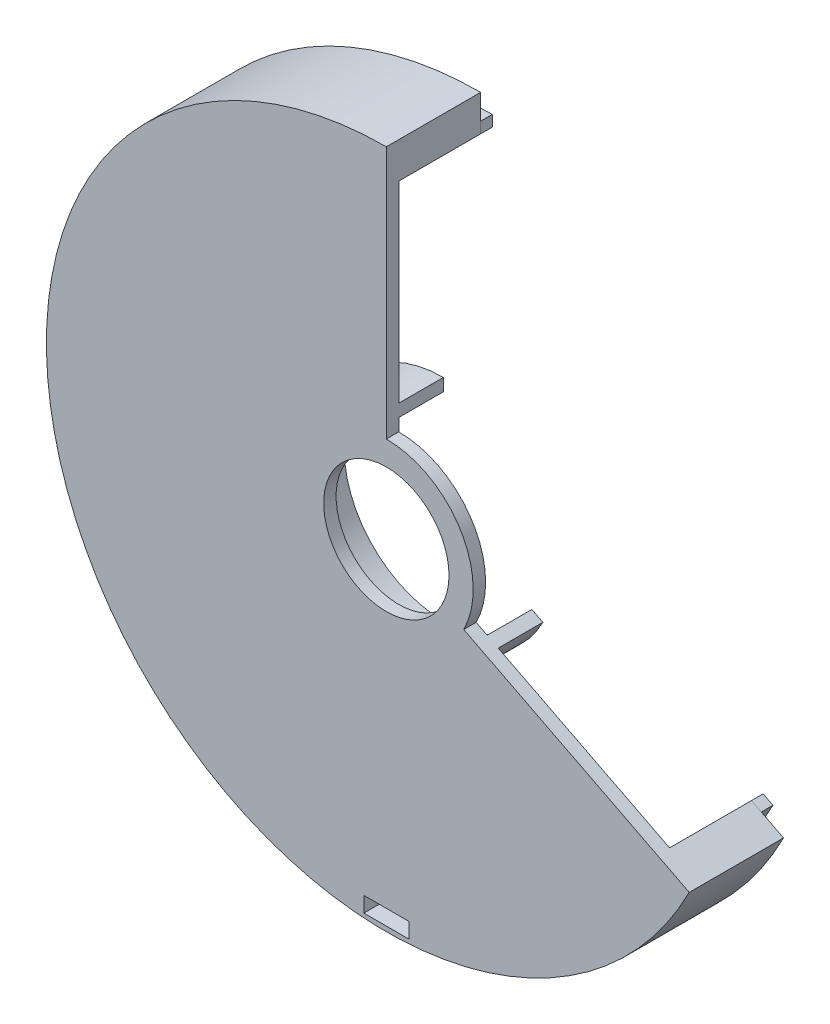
SolidWorks part; units mm, degrees
ref_plane "Přední rovina" through (0, 0, 0) normal (0, 0, 1) x (1, 0, 0)
ref_plane "Horní rovina" through (0, 0, 0) normal (0, 1, 0) x (1, 0, 0)
ref_plane "Pravá rovina" through (0, 0, 0) normal (1, 0, 0) x (0, 0, -1)
sketch "Skica1" plane through (0, 0, 0) normal (0, 0, 1) x (1, 0, 0)
  circle A0 centre (0, 0) radius 126.95
  circle A1 centre (0, 0) radius 122.5
  dimension "D1" = 253.9
  dimension "D2" = 245
extrude "Přidat vysunutím1" add sketch "Skica1" along normal blind 4.7023
sketch "Skica2" plane through (0, 0, 4.7023) normal (0, 0, 1) x (1, 0, 0)
  circle A0 centre (0, 0) radius 122.5
  circle A1 centre (0, 0) radius 137
  dimension "D1" = 245
  dimension "D2" = 274
extrude "Přidat vysunutím2" add sketch "Skica2" along normal blind 38 separate body
sketch "Skica3" plane through (0, 0, 42.7023) normal (0, 0, 1) x (1, 0, 0)
  circle A0 centre (0, 0) radius 137
  circle A1 centre (0, 0) radius 25.25
  dimension "D1" = 50.5
extrude "Přidat vysunutím3" add sketch "Skica3" against normal blind 5
sketch "Skica4" plane through (0, 0, 42.7023) normal (0, 0, 1) x (1, 0, 0)
  circle A0 centre (0, 0) radius 25.25
  circle A1 centre (0, 0) radius 35
  dimension "D1" = 70
  dimension "D2" = 50.5
extrude "Přidat vysunutím4" add sketch "Skica4" along normal blind 25
sketch "Skica5" plane through (0, 0, 67.7023) normal (0, 0, 1) x (1, 0, 0)
  circle A0 centre (0, 0) radius 30.25
  dimension "D1" = 60.5
extrude "Odebrat vysunutím1" cut sketch "Skica5" against normal blind 5
sketch "Skica6" plane through (0, 0, 42.7023) normal (0, 0, 1) x (1, 0, 0)
  line L0 (0, 137) -> (0, -137) construction
  line L1 (-137, 0) -> (137, 0) construction
  line L2 (9.07, -135) -> (-9.07, -135)
  line L3 (-9.07, -135) -> (-9.07, -128.81)
  line L4 (9.07, -135) -> (9.07, -128.81)
  line L5 (-9.07, -128.81) -> (9.07, -128.81)
  circle A0 centre (0, 0) radius 137 construction
  circle A1 centre (0, 0) radius 135 construction
  point P14 (0, -135)
  dimension "D1" = 270
  dimension "D2" = 9.07
  dimension "D3" = 6.19
extrude "Odebrat vysunutím2" cut sketch "Skica6" against normal blind 65
sketch "Skica8" plane through (0, 0, 0) normal (0, 1, 0) x (1, 0, 0)
  line L0 (-35, -42.7023) -> (35, -42.7023) construction
  line L1 (0, 0) -> (0, -50.5) construction
  circle A0 centre (0, -50.5) radius 5
  dimension "D3" = 10
  dimension "D1" = 42.7023
  dimension "D2" = 50.5
extrude "Odebrat vysunutím3" cut sketch "Skica8" against normal blind 65
sketch "Skica9" plane through (0, 0, 37.7023) normal (0, 0, -1) x (-1, 0, 0)
  circle A0 centre (0, 0) radius 40
  circle A1 centre (0, 0) radius 45
  dimension "D1" = 80
  dimension "D2" = 90
extrude "Přidat vysunutím5" add sketch "Skica9" along normal blind 18
sketch "Skica12" plane through (0, 0, 19.7023) normal (0, 0, -1) x (-1, 0, 0)
  circle A0 centre (0, 0) radius 45
  circle A1 centre (0, 0) radius 25
  dimension "D1" = 90
  dimension "D2" = 50
extrude "Přidat vysunutím7" [suppressed] add sketch "Skica12" along normal blind 5
scale "Měřítko1" bodies to scale 101 114 scale about origin uniform scaling yes scale factor 0.655
sketch "Skica13" plane through (0, 0, 27.97) normal (0, 0, 1) x (1, 0, 0)
  line L0 (0, 0) -> (79.9545, -40.7388)
  line L2 (0, 0) -> (0, 89.735)
  circle A1 centre (0, 0) radius 89.735
  circle A2 centre (0, 0) radius 89.735
  dimension "D2" = 117
  dimension "D1" = 0
sketch "Skica14" plane through (0, 0, 27.97) normal (0, 0, 1) x (1, 0, 0)
  circle A0 centre (0, 0) radius 165.5762
extrude "Odebrat vysunutím4" cut sketch "Skica13" against normal through all and the other way through all contours L2 L0 M9 M8
extrude "Odebrat vysunutím5" cut sketch "Skica14" along normal through all
